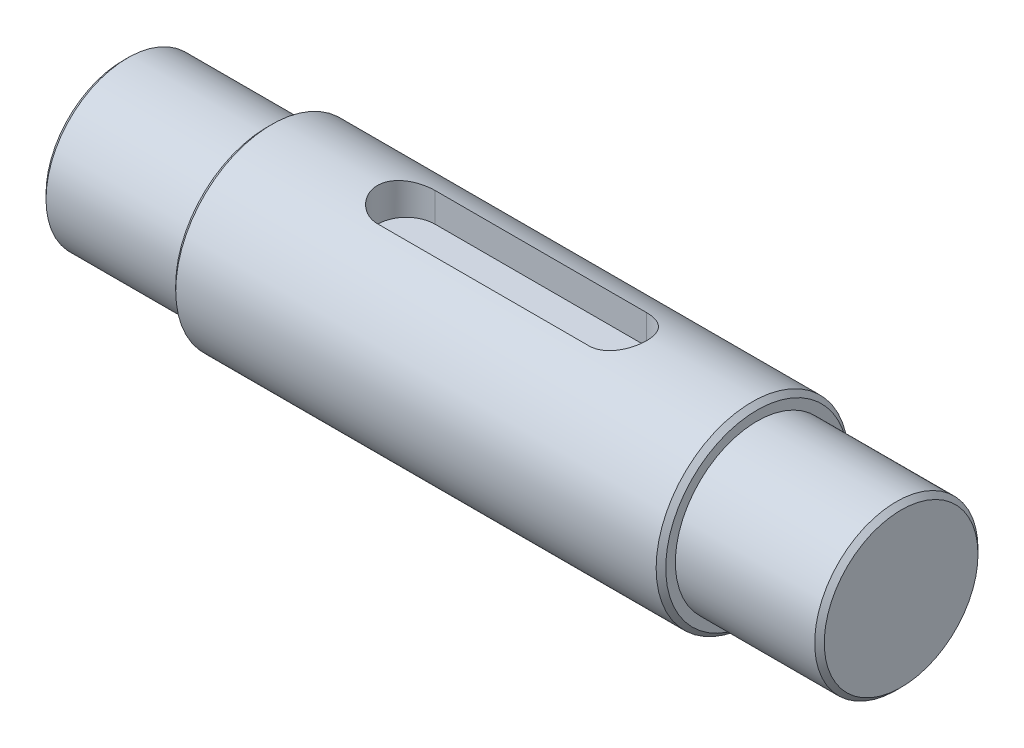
SolidWorks part; units mm, degrees
ref_plane "Front Plane" through (0, 0, 0) normal (0, 0, 1) x (1, 0, 0)
ref_plane "Top Plane" through (0, 0, 0) normal (0, 1, 0) x (1, 0, 0)
ref_plane "Right Plane" through (0, 0, 0) normal (1, 0, 0) x (0, 0, -1)
ref_plane "Plane1" through (0, 0, 0) normal (0, 0, -1) x (-1, 0, 0)
sketch "Sketch1" plane through (0, 0, 0) normal (0, 0, -1) x (-1, 0, 0)
  line L0 (-66, 10) -> (-66, 0)
  line L1 (-66, 0) -> (-15, 0)
  line L2 (-15, 0) -> (-15, 10)
  line L3 (-15, 10) -> (-66, 10)
  line L4 (-66, 0) -> (-15, 0) construction
  dimension "D1" = 51
  dimension "D2" = 10
revolve "Revolve1" add sketch "Sketch1" angle 360 about L4
sketch "Sketch2" plane through (15, 0, 0) normal (-1, 0, 0) x (0, 0, 1)
  circle A0 centre (0, 0) radius 8.5
  dimension "D1" = 17
extrude "Boss-Extrude1" add sketch "Sketch2" along normal blind 15
sketch "Sketch3" plane through (66, 0, 0) normal (1, 0, 0) x (0, 0, -1)
  circle A0 centre (0, 0) radius 8.5
  dimension "D1" = 17
extrude "Boss-Extrude2" add sketch "Sketch3" along normal blind 15
ref_plane "Plane2" through (0, 6.5, 0) normal (0, -1, 0) x (1, 0, 0)
sketch "Sketch4" plane through (0, 6.5, 0) normal (0, -1, 0) x (1, 0, 0)
  line L0 (51.5, 3) -> (29.5, 3)
  line L1 (29.5, -3) -> (51.5, -3)
  arc A0 (51.5, -3) -> (51.5, 3) centre (51.5, 0) ccw
  arc A1 (29.5, 3) -> (29.5, -3) centre (29.5, 0) ccw
  dimension "D1" = 3
  dimension "D2" = 22
chamfer "Chamfer1" distance 0.5 angle 45 4 edges at (66, 0, 10) (15, 0, 10) (0, 0, 8.5) (81, 0, -8.5)
extrude "Cut-Extrude2" cut sketch "Sketch4" against normal blind 10
